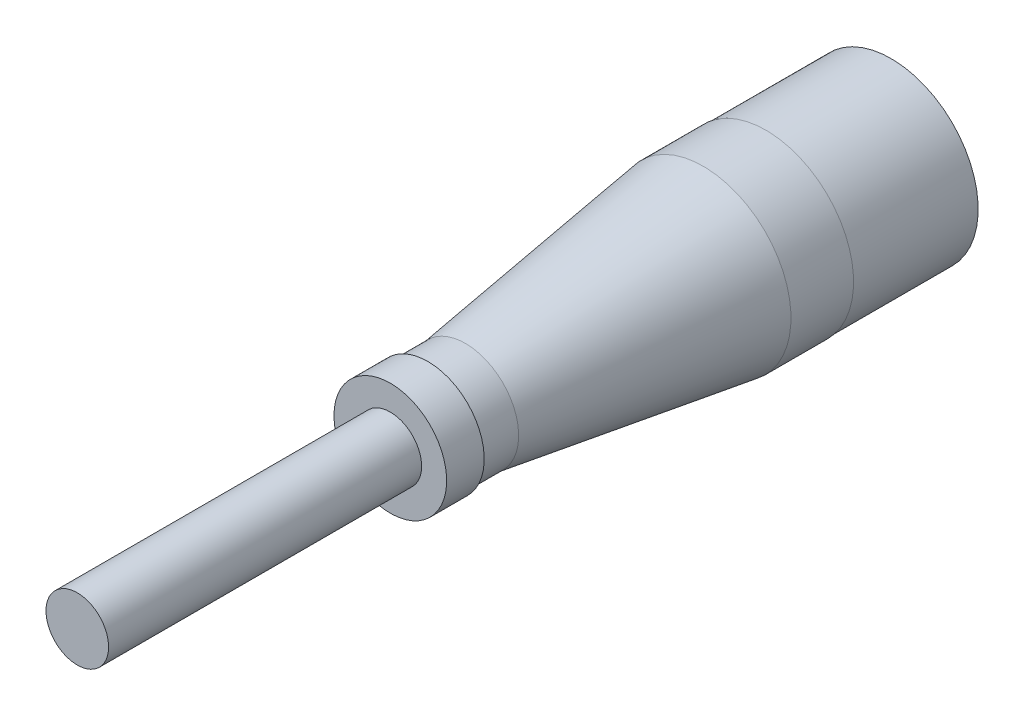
SolidWorks part; units mm, degrees
ref_plane "Plan de face" through (0, 0, 0) normal (0, 0, 1) x (1, 0, 0)
ref_plane "Plan de dessus" through (0, 0, 0) normal (0, 1, 0) x (1, 0, 0)
ref_plane "Plan de droite" through (0, 0, 0) normal (1, 0, 0) x (0, 0, -1)
ref_plane "Plan1" through (0, 0, 15) normal (0, 0, 1) x (1, 0, 0)
sketch "Esquisse1" plane through (0, 0, 0) normal (0, 0, 1) x (1, 0, 0)
  circle A0 centre (0, 0) radius 6.95
  dimension "D1" = 13.9
extrude "Extrusion1" add sketch "Esquisse1" along normal blind 10
sketch "Esquisse2" plane through (0, 0, 10) normal (0, 0, 1) x (1, 0, 0)
  circle A0 centre (0, 0) radius 7
  circle A1 centre (0, 0) radius 6.95 construction
  dimension "D1" = 14
extrude "Extrusion2" add sketch "Esquisse2" along normal blind 5
sketch "Esquisse3" plane through (-25, 0, 25) normal (0, 1, 0) x (-1, 0, 0)
  line L0 (-25, -10) -> (-25, 15)
  line L1 (-25, 15) -> (-29.5, 15)
  line L2 (-29.5, 15) -> (-29.5, 12)
  line L3 (-29.5, 12) -> (-29.25, 12)
  line L4 (-29.25, 12) -> (-29.25, 9)
  line L5 (-29.25, 9) -> (-32, -10)
  line L7 (-32, -10) -> (-25, -10)
  line L8 (-17.3, -10) -> (-32.7, -10) construction
  line L9 (-25, -17.3) -> (-25, -32.7) construction
  dimension "D1" = 7
  dimension "D2" = 4.5
  dimension "D3" = 3
  dimension "D4" = 25
  dimension "D5" = 3
  dimension "D6" = 4.25
revolve "Révolution1" add sketch "Esquisse3" angle 360 about L0
sketch "Esquisse4" plane through (0, 0, 40) normal (0, 0, 1) x (-1, 0, 0)
  circle A0 centre (0, 0) radius 2.5
  circle A1 centre (0, 0) radius 4.5 construction
  dimension "D1" = 5
extrude "Extrusion3" add sketch "Esquisse4" along normal blind 25
sketch "Esquisse5" plane through (0, 0, 0) normal (0, 0, -1) x (-1, 0, 0)
  circle A0 centre (0, 0) radius 6
  dimension "D1" = 12
extrude "Enlèv. mat.-Extru.1" cut sketch "Esquisse5" against normal blind 9
